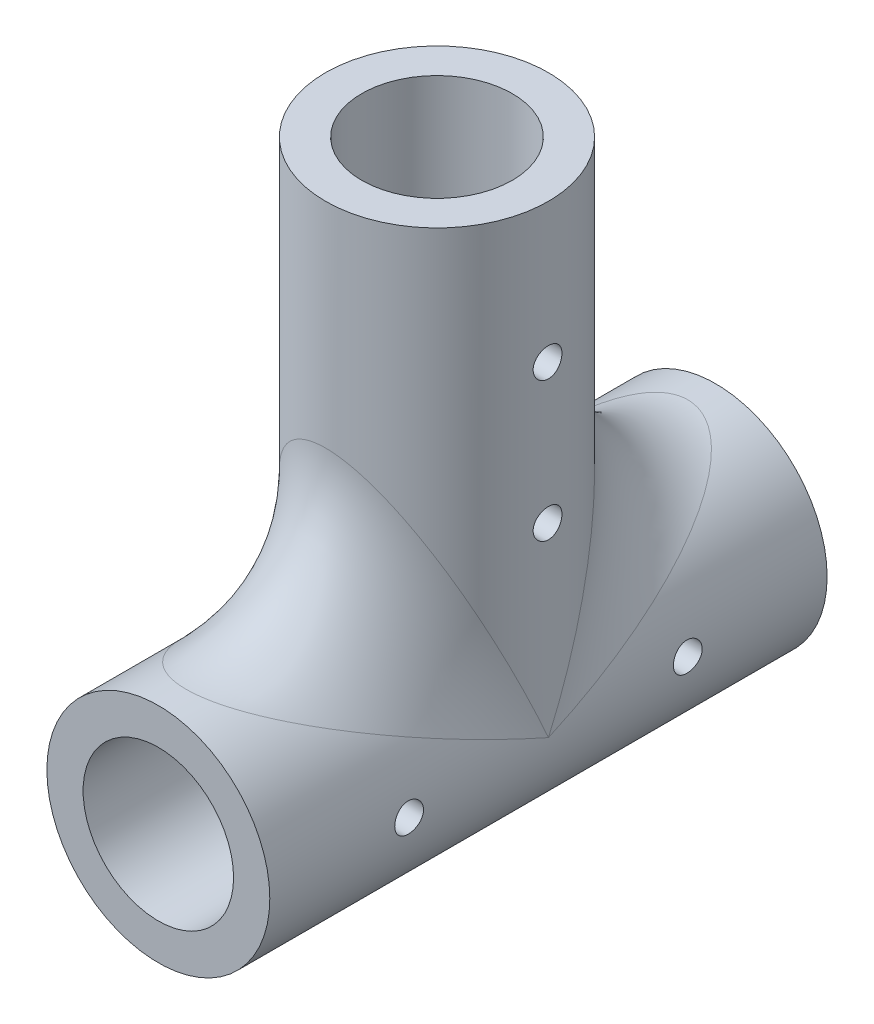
SolidWorks part; units mm, degrees
ref_plane "前视基准面" through (0, 0, 0) normal (0, 0, 1) x (1, 0, 0)
ref_plane "上视基准面" through (0, 0, 0) normal (0, 1, 0) x (1, 0, 0)
ref_plane "右视基准面" through (0, 0, 0) normal (1, 0, 0) x (0, 0, -1)
other "Configuration Table"
sketch "草图1" plane through (0, 0, 0) normal (0, 0, 1) x (1, 0, 0)
  circle A0 centre (0, 0) radius 12
extrude "凸台-拉伸1" add sketch "草图1" along normal blind 60
ref_point "点1"
ref_plane "基准面1" through (0, 0, 0) normal (0, 1, 0) x (1, 0, 0)
sketch "草图2" plane through (0, 0, 0) normal (0, 1, 0) x (1, 0, 0)
  line L0 (0, 0) -> (0, -60) construction
  line L1 (-12, -60) -> (12, -60) construction
  circle A0 centre (0, -30) radius 12
  circle A1 centre (0, -30) radius 8.1
extrude "凸台-拉伸2" add sketch "草图2" along normal blind 50
ref_plane "基准面2" through (0, 0, 0) normal (1, 0, 0) x (0, 0, -1)
sketch "草图3" plane through (0, 0, 60) normal (0, 0, 1) x (1, 0, 0)
  circle A0 centre (0, 0) radius 8.1
extrude "切除-拉伸1" cut sketch "草图3" against normal through all
sketch "草图4" plane through (0, 0, 0) normal (1, 0, 0) x (0, 0, -1)
  line L0 (13.2, 0) -> (-13.2, 0) construction
  line L1 (-18, 50) -> (-42, 50) construction
  line L2 (-60, 12) -> (-60, -12) construction
  line L3 (0, -12) -> (0, 12) construction
  circle A0 centre (-45, 0) radius 1.55
  circle A2 centre (-30, 35) radius 1.55
  circle A3 centre (-30, 20) radius 1.55
  circle A4 centre (-15, 0) radius 1.55
  dimension "D1" = 15
  dimension "D2" = 15
  dimension "D3" = 15
  dimension "D6" = 15
extrude "切除-拉伸2" cut sketch "草图4" against normal through all and the other way through all
sketch "草图5" plane through (0, 50, 0) normal (0, 1, 0) x (1, 0, 0)
  circle A0 centre (0, -30) radius 8.1
extrude "切除-拉伸3" cut sketch "草图5" against normal blind 40
fillet "圆角2" radius 15 2 edges at (0, 12, 42) (0, 12, 18)
